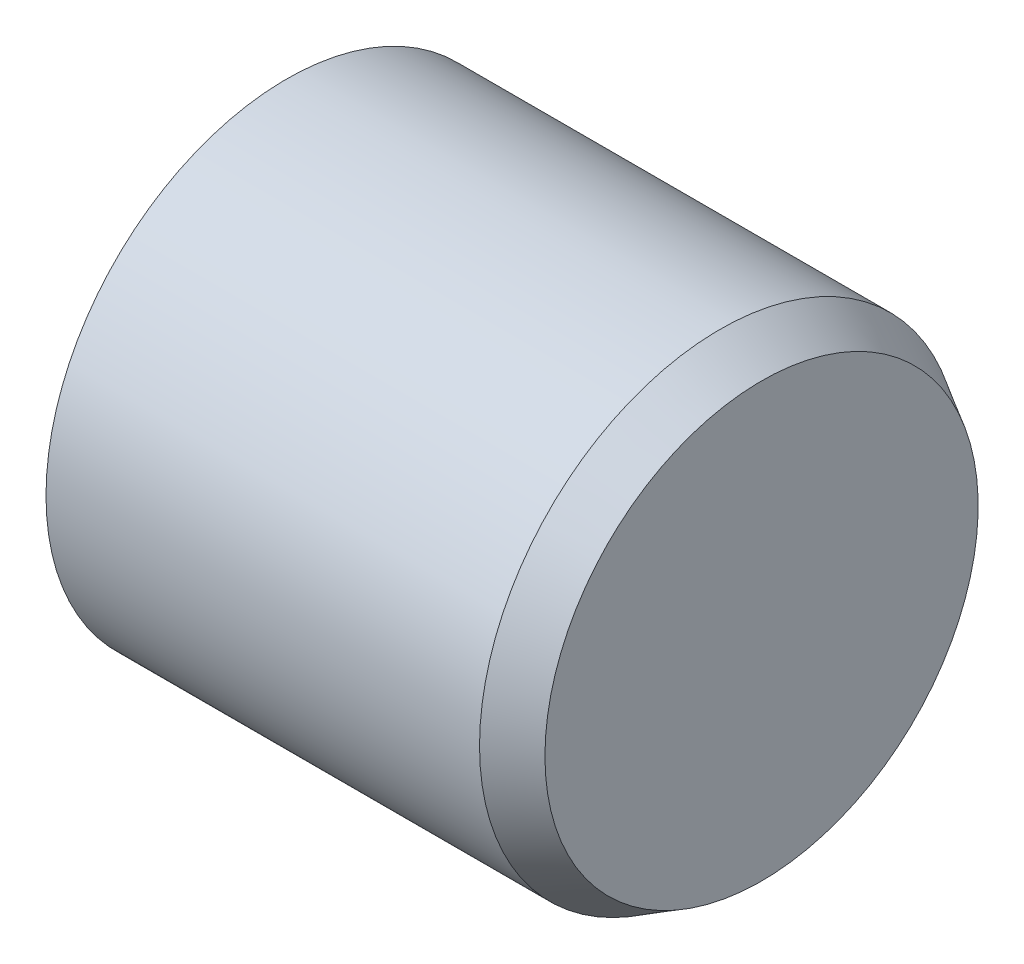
SolidWorks part; units mm, degrees
ref_plane "Спереди" through (0, 0, 0) normal (0, 0, 1) x (1, 0, 0)
ref_plane "Сверху" through (0, 0, 0) normal (0, 1, 0) x (1, 0, 0)
ref_plane "Справа" through (0, 0, 0) normal (1, 0, 0) x (0, 0, -1)
sketch "Эскиз1" plane through (0, 0, 0) normal (0, 0, 1) x (1, 0, 0)
  line L1 (0, 0) -> (0, 3.9878)
  line L2 (0, 3.9878) -> (7.1866, 3.9878)
  line L3 (7.1866, 3.9878) -> (7.874, 3.5909)
  line L4 (7.874, 3.5909) -> (7.874, 0)
  line L5 (7.874, 0) -> (0, 0)
  line L6 (-11.7024, 0) -> (35.0699, 0) construction
  dimension "D1" = 7.874
  dimension "D2" = 30
  dimension "D3" = 7.9756
  dimension "D4" = 0.3969
revolve "Повернуть2" add sketch "Эскиз1" angle 360 about L6
